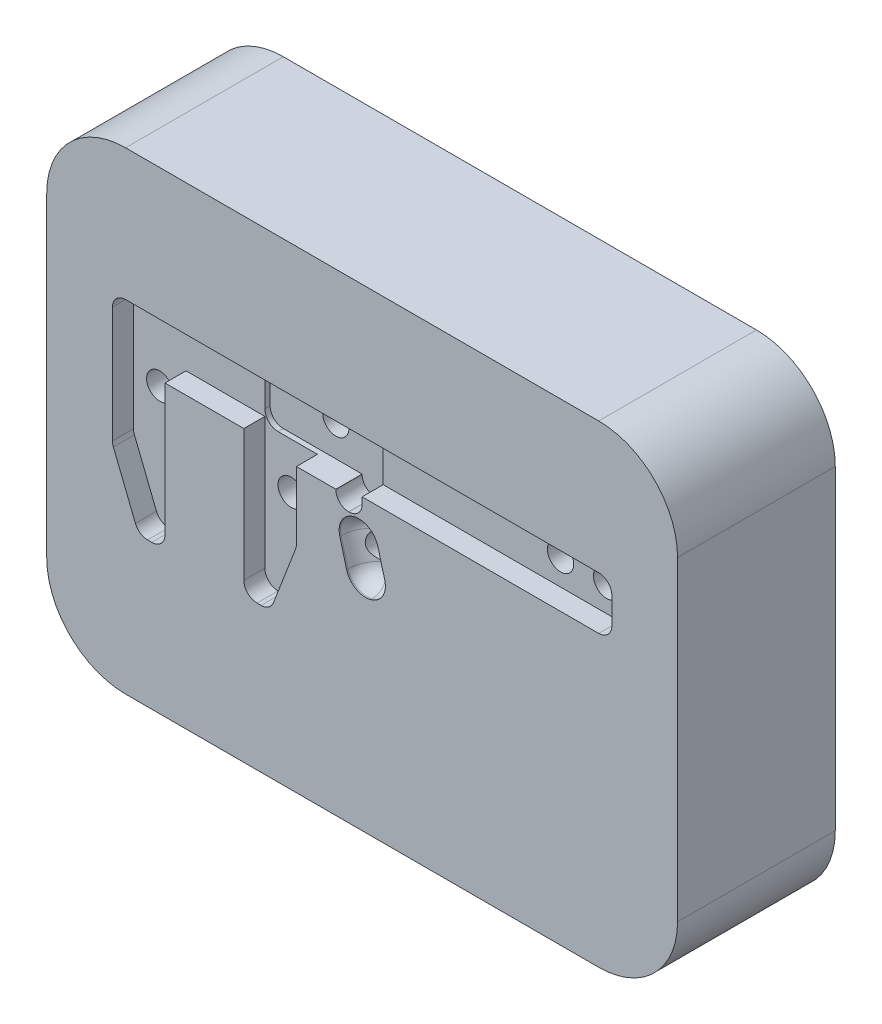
SolidWorks part; units mm, degrees
ref_plane "Plan de face" through (0, 0, 0) normal (0, 0, 1) x (1, 0, 0)
ref_plane "Plan de dessus" through (0, 0, 0) normal (0, 1, 0) x (1, 0, 0)
ref_plane "Plan de droite" through (0, 0, 0) normal (1, 0, 0) x (0, 0, -1)
sketch "Esquisse1" plane through (0, 0, 0) normal (0, 0, 1) x (1, 0, 0)
  line L0 (0, 26.5556) -> (0, -31.9133) construction
  line L1 (-18, 18) -> (18, 18)
  line L2 (-24, 12) -> (-24, -12)
  line L3 (-18, -18) -> (18, -18)
  line L4 (24, 12) -> (24, -12)
  line L5 (-36.2228, 0) -> (39.251, 0) construction
  arc A0 (18, 18) -> (24, 12) centre (18, 12) cw
  arc A1 (-18, 18) -> (-24, 12) centre (-18, 12) ccw
  arc A2 (-24, -12) -> (-18, -18) centre (-18, -12) ccw
  arc A3 (18, -18) -> (24, -12) centre (18, -12) ccw
  dimension "D3" = 6
  dimension "D1" = 36
  dimension "D2" = 48
extrude "Extrusion1" add sketch "Esquisse1" along normal blind 12
sketch "Esquisse2" plane through (0, 0, 12) normal (0, 0, 1) x (1, 0, 0)
  line L0 (18, 8) -> (-18, 8)
  line L1 (-19, 7) -> (-19, -1.8074)
  line L2 (-18.9285, -2.1788) -> (-17.2514, -6.3714)
  line L3 (-16.323, -7) -> (-16, -7)
  line L4 (-15, -6) -> (-15, 4)
  line L5 (18, 4) -> (-5, 4)
  line L6 (-9, 4) -> (-9, -6)
  line L8 (-6.7533, -6.3594) -> (-5.0668, -1.9809)
  line L9 (-5, -1.6215) -> (-5, 4)
  line L10 (-9, 4) -> (-15, 4)
  line L11 (-8, -7) -> (-7.6864, -7)
  line L13 (19, 5) -> (19, 7)
  line L14 (18, 18) -> (-18, 18) construction
  line L15 (24, -12) -> (24, 12) construction
  arc A0 (18, 8) -> (19, 7) centre (18, 7) cw
  arc A1 (-18, 8) -> (-19, 7) centre (-18, 7) ccw
  arc A2 (-19, -1.8074) -> (-18.9285, -2.1788) centre (-18, -1.8074) ccw
  arc A3 (-17.2514, -6.3714) -> (-16.323, -7) centre (-16.323, -6) ccw
  arc A4 (18, 4) -> (19, 5) centre (18, 5) ccw
  arc A5 (-16, -7) -> (-15, -6) centre (-16, -6) ccw
  arc A6 (-5.0668, -1.9809) -> (-5, -1.6215) centre (-6, -1.6215) ccw
  arc A7 (-6.7533, -6.3594) -> (-7.6864, -7) centre (-7.6864, -6) cw
  arc A8 (-9, -6) -> (-8, -7) centre (-8, -6) ccw
  point P10 (-19, 8)
  point P18 (-19, -2)
  point P22 (-17, -7)
  point P27 (-15, -7)
  point P35 (-5, -1.8074)
  point P38 (-7, -7)
  point P40 (-9, -7)
  dimension "D12" = 6
  dimension "D10" = 1
  dimension "D3" = 1
  dimension "D11" = 1
  dimension "D16" = 1
  dimension "D17" = 1
  dimension "D2" = 4
  dimension "D4" = 10
  dimension "D5" = 38
  dimension "D6" = 5
  dimension "D7" = 15
  dimension "D8" = 10
  dimension "D9" = 2
  dimension "D13" = 4
  dimension "D14" = 2
  dimension "D15" = 4
extrude "Enlèv. mat.-Extru.1" cut sketch "Esquisse2" against normal blind 1.6
sketch "Esquisse5" plane through (0, 0, 12) normal (0, 0, 1) x (1, 0, 0)
  line L0 (-9, 7) -> (-9, 4.5)
  line L1 (0, 7) -> (0, 3.5)
  line L2 (18, 8) -> (-18, 8) construction
  line L3 (-8, 8) -> (-1, 8)
  line L4 (18, 8) -> (-18, 8) construction
  line L5 (-8, 3.5) -> (-2, 3.5)
  line L6 (-2, 3.5) -> (-2, 3.47)
  line L7 (-1.03, 2.5) -> (-1, 2.5)
  line L8 (-9, 4) -> (-9, -6) construction
  arc A0 (0, 3.5) -> (-1, 2.5) centre (-1, 3.5) cw
  arc A1 (-1, 8) -> (0, 7) centre (-1, 7) cw
  arc A2 (-9, 7) -> (-8, 8) centre (-8, 7) cw
  arc A3 (-8, 3.5) -> (-9, 4.5) centre (-8, 4.5) cw
  arc A4 (-2, 3.47) -> (-1.03, 2.5) centre (-1.03, 3.47) ccw
  point P15 (0, 8)
  point P18 (-9, 8)
  dimension "D2" = 1
  dimension "D4" = 1
  dimension "D5" = 0.97
  dimension "D6" = 1
  dimension "D7" = 1
  dimension "D8" = 1
  dimension "D1" = 2
  dimension "D3" = 4.5
extrude "Enlèv. mat.-Extru.2" cut sketch "Esquisse5" against normal blind 2
sketch "Esquisse6" plane through (0, 0, 10.4) normal (0, 0, 1) x (1, 0, 0)
  line L0 (18, 8) -> (-1, 8) construction
  line L1 (19, 5) -> (19, 7) construction
  circle A0 centre (17, 6) radius 1
  point P4 (19, 6)
  dimension "D1" = 2
  dimension "D2" = 2
  dimension "D3" = 2
extrude "Enlèv. mat.-Extru.3" cut sketch "Esquisse6" against normal through all
sketch "Esquisse7" plane through (0, 0, 12) normal (0, 0, 1) x (1, 0, 0)
  line L0 (0.6559, -2.4479) -> (-0.6382, 2.3817)
  line L1 (0, 0.6964) -> (0, -0.937) construction
  dimension "D1" = 165
  dimension "D2" = 5
extrude "Enlèv. de mat.-Extru.-Mince1" cut sketch "Esquisse7" against normal blind 1.6 thin
fillet "Congé1" radius 1.5 4 edges at (0.6559, -2.4479, 10.4) (-0.6382, 2.3817, 10.4) (1.4578, 0.3551, 10.4) (-1.44, -0.4213, 10.4)
fillet "Congé2" radius 1.5 8 edges at (2.1048, -2.0597, 11.95) (-0.793, -2.8362, 11.95) (-2.0871, 1.9935, 11.95) (0.8107, 2.7699, 11.95) (1.5667, -1.749, 10.8393) (-0.4823, -2.2981, 10.8393) (-1.549, 1.6828, 10.8393) (0.5001, 2.2318, 10.8393)
hole_wizard "Trou taraudé M41" positions "Esquisse9" profile "Esquisse8" tap size "M4" standard "ISO"
sketch "Esquisse9" plane through (0, 0, 0) normal (0, 0, -1) x (-1, 0, 0)
  line L0 (0, 9.4863) -> (0, -6.8477) construction
  line L2 (-3.6123, 0) -> (4.1149, 0) construction
  point P0 (18, 12)
  point P1 (-18, 12)
  point P3 (-18, -12)
  point P5 (18, -12)
  dimension "D1" = 18
  dimension "D2" = 12
sketch "Esquisse8" plane through (-18, 12, 0) normal (1, 0, 0) x (0, 1, 0)
  line L0 (0, 0) -> (0, 11.0914)
  line L1 (0, 11.0914) -> (1.65, 10.1)
  line L2 (1.65, 10.1) -> (1.65, 0)
  line L5 (1.65, 0) -> (0, 0)
  line L10 (0, 11.0914) -> (-1.65, 10.1) construction
  line L11 (0, -6.35) -> (0, 107.95) construction
  dimension "Diamètre du trou pour taraudage" = 3.3
  dimension "Profondeur du trou pour taraudage" = 10.1
  dimension "Angle de pointe" = 118
sketch "Esquisse10" plane through (0, 0, 0) normal (0, 0, -1) x (-1, 0, 0)
  circle A0 centre (-17, 6) radius 2
  dimension "D1" = 4
extrude "Enlèv. mat.-Extru.4" cut sketch "Esquisse10" against normal blind 3
sketch "Esquisse11" plane through (0, 0, 10.4) normal (0, 0, 1) x (1, 0, 0)
  line L0 (18, 8) -> (-1, 8) construction
  line L1 (0, 3.5) -> (0, 7) construction
  line L2 (-1, 8) -> (-8, 8) construction
  line L3 (-15, -6) -> (-15, 4) construction
  line L4 (-8, 8) -> (-18, 8) construction
  line L5 (-5, -1.6215) -> (-5, 3.5) construction
  line L6 (0, -3.8322) -> (0, 13.4442) construction
  line L7 (-3.361, 0) -> (5.1201, 0) construction
  circle A0 centre (13.5, 6) radius 1
  circle A1 centre (-4, 6) radius 1
  circle A2 centre (-17, 2) radius 1
  circle A3 centre (17, 6) radius 1 construction
  circle A4 centre (-7, 0) radius 1
  dimension "D1" = 2
  dimension "D2" = 2
  dimension "D3" = 3.5
  dimension "D4" = 4
  dimension "D5" = 2
  dimension "D6" = 2
  dimension "D7" = 6
  dimension "D8" = 2
extrude "Enlèv. mat.-Extru.5" cut sketch "Esquisse11" against normal through all
sketch "Esquisse12" plane through (0, 0, 12) normal (0, 0, 1) x (1, 0, 0)
  circle A0 centre (0, 0) radius 1
  dimension "D1" = 2
extrude "Enlèv. mat.-Extru.6" cut sketch "Esquisse12" against normal through all
